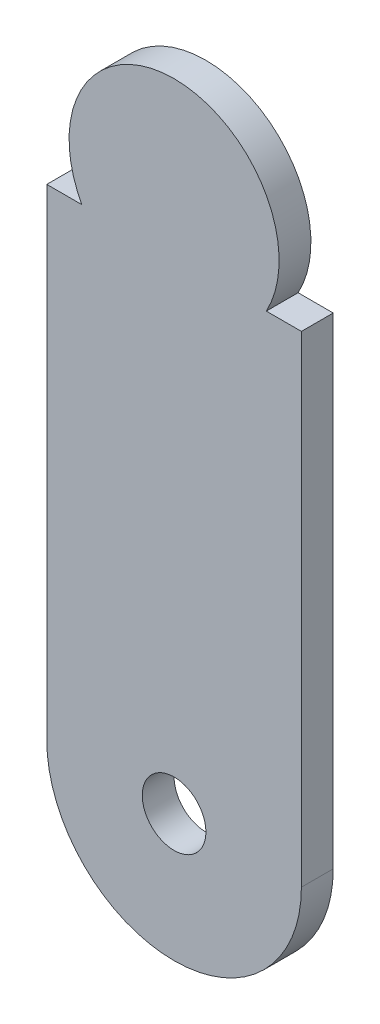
SolidWorks part; units mm, degrees
ref_plane "Front Plane" through (0, 0, 0) normal (0, 0, 1) x (1, 0, 0)
ref_plane "Top Plane" through (0, 0, 0) normal (0, 1, 0) x (1, 0, 0)
ref_plane "Right Plane" through (0, 0, 0) normal (1, 0, 0) x (0, 0, -1)
sketch "Sketch1" plane through (0, 0, 0) normal (0, 0, 1) x (1, 0, 0)
  line L0 (-4.783, 11.9574) -> (9.1966, -22.9914) construction
  line L1 (9.1985, 16.2661) -> (12.7, 16.2661)
  line L2 (-12.7, -31.75) -> (-12.7, 16.2661)
  line L4 (12.7, -31.75) -> (12.7, 16.2661)
  line L5 (-9.1966, -22.9914) -> (0, 0) construction
  line L7 (-12.7, 16.2661) -> (-9.1985, 16.2661)
  arc A0 (-12.7, -31.75) -> (12.7, -31.75) centre (0, -31.75) ccw
  circle A1 centre (0, -31.75) radius 3.175
  arc A2 (9.1985, 16.2661) -> (-9.1985, 16.2661) centre (0, 21.2758) ccw
  point P0 (0, 0)
extrude "Boss-Extrude1" add sketch "Sketch1" along normal blind 3.175
